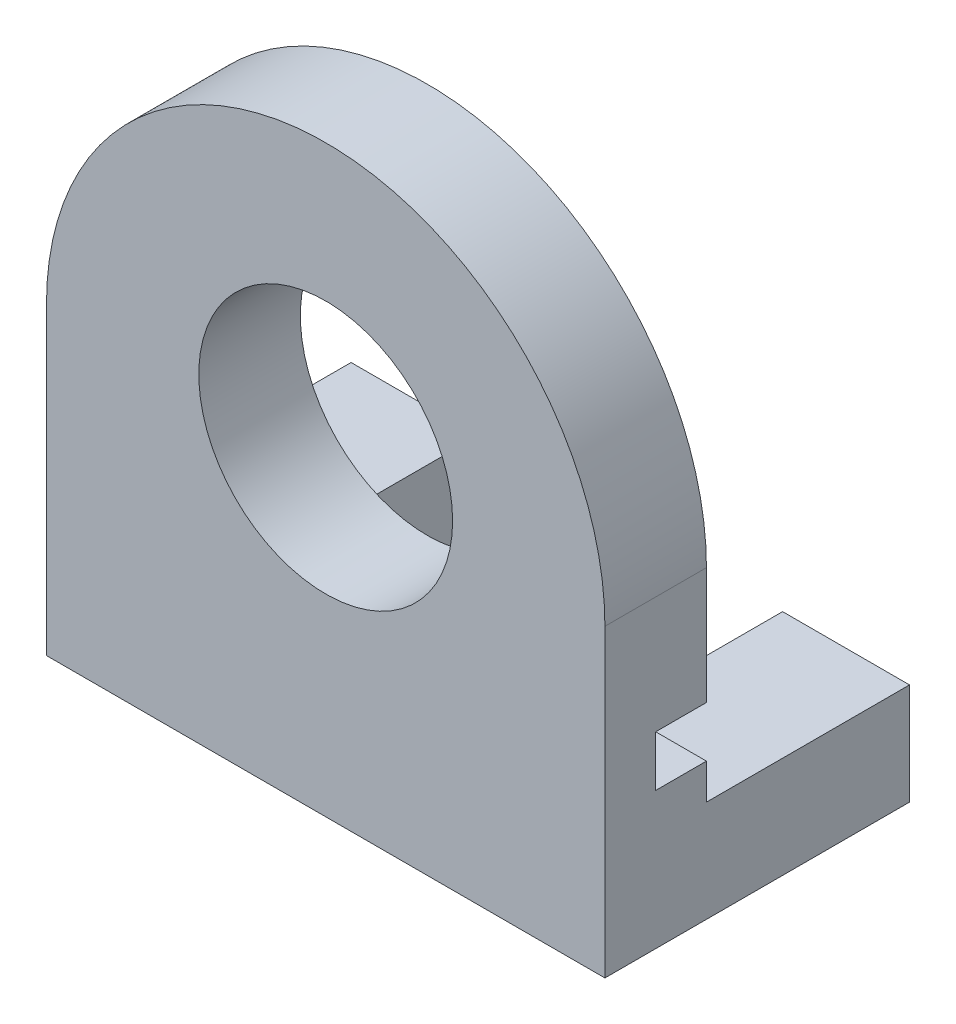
SolidWorks part; units mm, degrees
ref_plane "Plan1" through (0, 0, 0) normal (0, 0, 1) x (1, 0, 0)
ref_plane "Plan2" through (0, 0, 0) normal (0, 1, 0) x (1, 0, 0)
ref_plane "Plan3" through (0, 0, 0) normal (1, 0, 0) x (0, 0, -1)
sketch "Esquisse1" plane through (0, 0, 0) normal (0, 0, 1) x (1, 0, 0)
  line L0 (0, 0) -> (11, 0)
  line L1 (11, 0) -> (11, 6)
  line L2 (0, 0) -> (0, 6)
  arc A0 (11, 6) -> (0, 6) centre (5.5, 6) ccw
  dimension "D1" = 11
  dimension "D2" = 6
extrude "Base-Extrusion" add sketch "Esquisse1" against normal blind 2
sketch "Esquisse2" plane through (0, 0, -2) normal (0, 0, -1) x (-1, 0, 0)
  line L0 (0, 0) -> (-20, 0) construction
  line L1 (-11, 0) -> (-11, 10.5576) construction
  line L2 (0, 0) -> (0, 10.5576) construction
  line L3 (0, 0) -> (0, 2)
  line L4 (0, 2) -> (-2.5, 2)
  line L5 (-2.5, 2) -> (-2.5, 0)
  line L6 (-2.5, 0) -> (0, 0)
  dimension "D1" = 2
  dimension "D2" = 2.5
extrude "Boss.-Extru.1" add sketch "Esquisse2" along normal blind 4
sketch "Esquisse3" plane through (0, 0, -2) normal (0, 0, -1) x (-1, 0, 0)
  line L0 (-11, 0) -> (10, 0) construction
  line L1 (-11, 0) -> (-11, 2)
  line L2 (-11, 0) -> (-11, 6) construction
  line L3 (-11, 2) -> (-8.5, 2)
  line L4 (-8.5, 2) -> (-8.5, 0)
  line L5 (-8.5, 0) -> (-11, 0)
  dimension "D1" = 2
  dimension "D2" = 2.5
extrude "Boss.-Extru.2" add sketch "Esquisse3" along normal blind 4
sketch "Esquisse4" plane through (0, 0, 0) normal (0, 0, 1) x (1, 0, 0)
  circle A0 centre (5.5, 6.3) radius 2.5
  dimension "D1" = 5
  dimension "D2" = 5.5
  dimension "D3" = 6.3
extrude "Enlèv. mat.-Extru.1" cut sketch "Esquisse4" against normal blind 2
sketch "Esquisse5" plane through (0, 0, 0) normal (-1, 0, 0) x (0, 0, 1)
  line L0 (-6, 0) -> (0, 0) construction
  line L1 (-2, 2.7) -> (-1, 2.7)
  line L2 (-1, 2.7) -> (-1, 3.7)
  line L3 (-1, 3.7) -> (-2, 3.7)
  line L4 (-2, 6) -> (-2, 2) construction
  line L5 (-2, 3.7) -> (-2, 2.7)
  dimension "D1" = 1
  dimension "D2" = 2.7
  dimension "D3" = 1
extrude "Enlèv. mat.-Extru.2" cut sketch "Esquisse5" against normal blind 11.5
